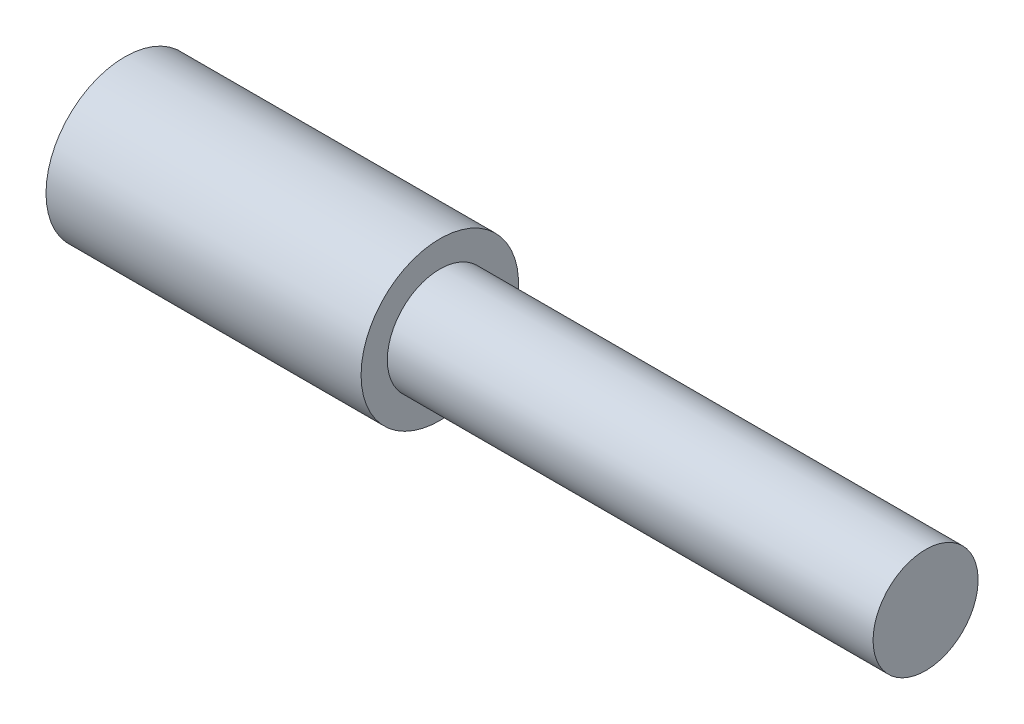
SolidWorks part; units mm, degrees
ref_plane "正面" through (0, 0, 0) normal (0, 0, 1) x (1, 0, 0)
ref_plane "平面" through (0, 0, 0) normal (0, 1, 0) x (1, 0, 0)
ref_plane "右側面" through (0, 0, 0) normal (1, 0, 0) x (0, 0, -1)
body saved out of another part "ｽﾄｯｸ-フロント機構部-1"
sketch "ｽｹｯﾁ1" plane through (90, 0, 0) normal (1, 0, 0) x (0, 0, -1)
  circle A1 centre (0, 0) radius 2
  circle A2 centre (0, 0) radius 2
  dimension "D1" = 0
extrude "ｶｯﾄ - 押し出し1" cut sketch "ｽｹｯﾁ1" against normal offset from surface (10.5 mm away) 4.5
